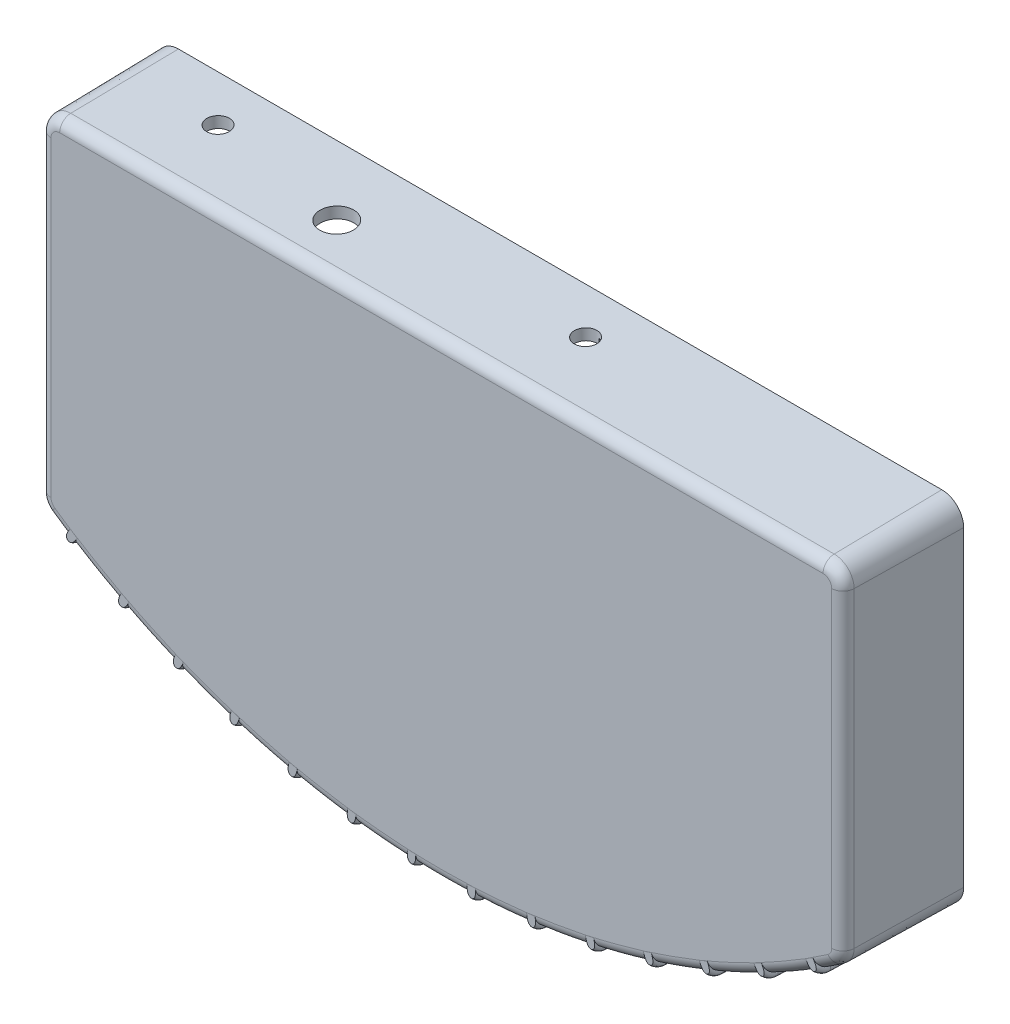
SolidWorks part; units mm, degrees
ref_plane "Plan1" through (0, 0, 0) normal (0, 0, 1) x (1, 0, 0)
ref_plane "Plan2" through (0, 0, 0) normal (0, 1, 0) x (1, 0, 0)
ref_plane "Plan3" through (0, 0, 0) normal (1, 0, 0) x (0, 0, -1)
imported_body "Importée1"
sketch "Esquisse1" plane through (0, 0.3664, 0.0064) normal (0, 0.9998, 0.0175) x (1, 0, 0)
  line L0 (3.5, -19.0314) -> (3.5, 0.0064) construction
  line L1 (138.5, 0.0064) -> (3.5, 0.0064) construction
  circle A0 centre (43.5, -11.9936) radius 3
  circle A1 centre (18.5, -7.9936) radius 2
  circle A2 centre (83.5, -7.9936) radius 2
  dimension "D1" = 6
  dimension "D2" = 40
  dimension "D3" = 12
  dimension "D4" = 4
  dimension "D5" = 4
  dimension "D6" = 8
  dimension "D7" = 8
  dimension "D9" = 80
  dimension "D8" = 15
extrude "Enlèv. mat.-Extru.1" cut sketch "Esquisse1" against normal blind 10
sketch "Esquisse3" plane through (0, 0, 4.5) normal (0, 0, -1) x (-1, 0, 0)
  line L1 (-67, -82.7014) -> (-75, -82.7014)
  line L2 (-67, -82.7014) -> (-67, -83.8976)
  line L3 (-67, -83.8976) -> (-75, -83.8976)
  line L4 (-75, -82.7014) -> (-75, -83.8976)
extrude "Enlèv. mat.-Extru.2" cut sketch "Esquisse3" along normal blind 10
